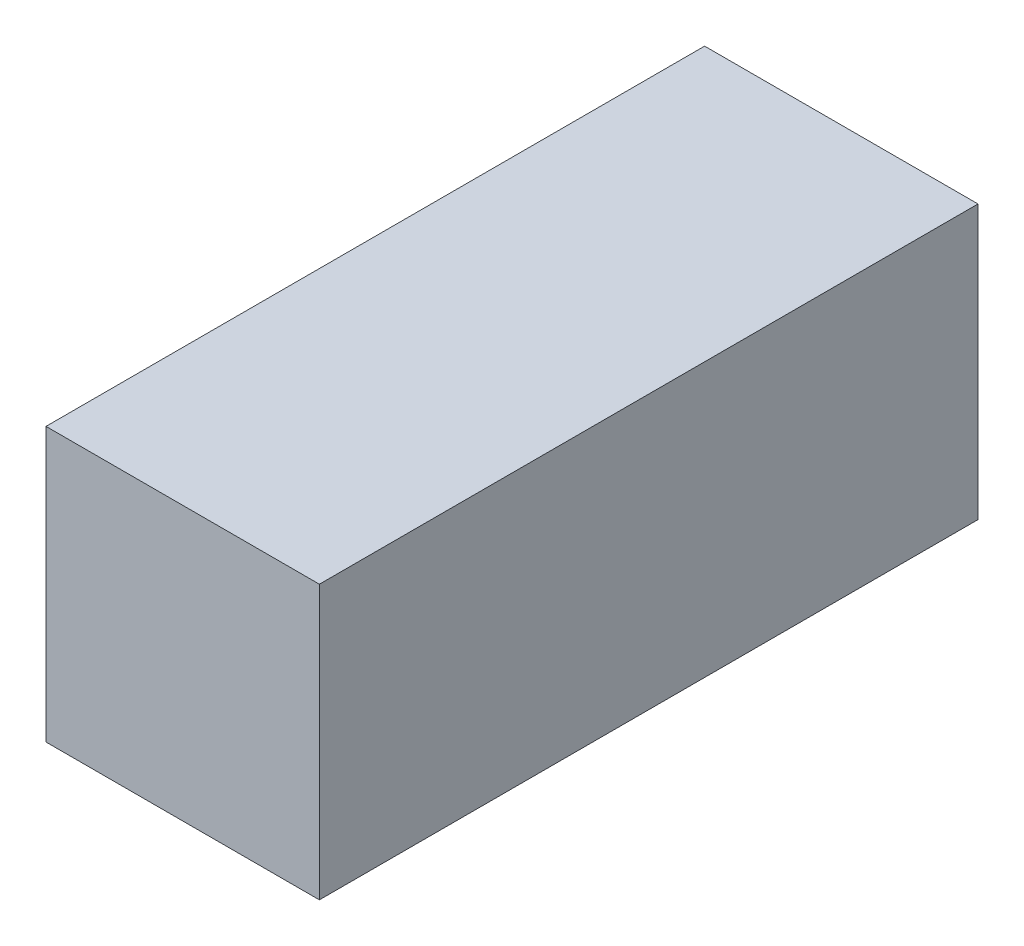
SolidWorks part; units mm, degrees
ref_plane "Plan de face" through (0, 0, 0) normal (0, 0, 1) x (1, 0, 0)
ref_plane "Plan de dessus" through (0, 0, 0) normal (0, 1, 0) x (1, 0, 0)
ref_plane "Plan de droite" through (0, 0, 0) normal (1, 0, 0) x (0, 0, -1)
sketch "Esquisse1" plane through (0, 0, 0) normal (0, 0, 1) x (1, 0, 0)
  line L1 (0, 0) -> (55, 0)
  line L2 (0, 0) -> (0, 55)
  line L3 (0, 55) -> (55, 55)
  line L4 (55, 0) -> (55, 55)
  dimension "D1" = 55
  dimension "D2" = 55
extrude "Extrusion1" add sketch "Esquisse1" along normal blind 132.5
sketch "Esquisse2" plane through (0, 0, 132.5) normal (0, 0, 1) x (1, 0, 0)
  line L0 (55, 55) -> (0, 0) construction
  line L1 (0, 55) -> (55, 0) construction
